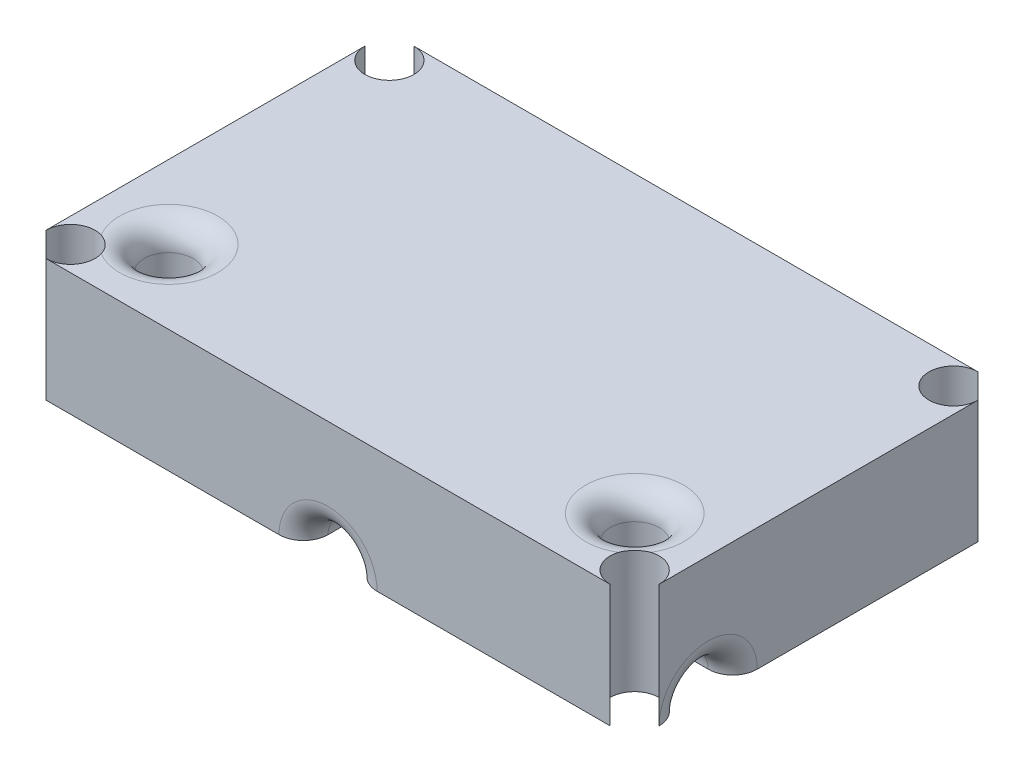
SolidWorks part; units mm, degrees
ref_plane "Front Plane" through (0, 0, 0) normal (0, 0, 1) x (1, 0, 0)
ref_plane "Top Plane" through (0, 0, 0) normal (0, 1, 0) x (1, 0, 0)
ref_plane "Right Plane" through (0, 0, 0) normal (1, 0, 0) x (0, 0, -1)
sketch "Sketch1" plane through (0, 0, 0) normal (0, 1, 0) x (1, 0, 0)
  line L0 (0, 0) -> (0, 1.1972) construction
  line L1 (11.5, -7.5) -> (-11.5, -7.5)
  line L2 (12.5, -6.5) -> (12.5, 6.5)
  line L3 (11.5, 7.5) -> (-11.5, 7.5)
  line L4 (-12.5, -6.5) -> (-12.5, 6.5)
  line L5 (0, 1.1972) -> (0, 0) construction
  line L6 (0, 0) -> (1.088, 0) construction
  arc A0 (-12.5, 6.5) -> (-11.5, 7.5) centre (-11.5, 6.5) ccw
  arc A1 (12.5, 6.5) -> (11.5, 7.5) centre (11.5, 6.5) cw
  arc A2 (12.5, -6.5) -> (11.5, -7.5) centre (11.5, -6.5) ccw
  arc A3 (-12.5, -6.5) -> (-11.5, -7.5) centre (-11.5, -6.5) cw
  point P0 (0, 0)
  point P11 (0, 0)
  point P13 (-6.507, 4.0703)
  dimension "D5" = 2
  dimension "D1" = 25
  dimension "D2" = 15
  dimension "D3" = 1
  dimension "D4" = 1
extrude "Boss-Extrude1" add sketch "Sketch1" along normal blind 5
sketch "Sketch2" plane through (12.5, 0, 0) normal (1, 0, 0) x (0, 0, -1)
  line L0 (-6.5, 0) -> (6.5, 0) construction
  circle A0 centre (-4.5, 0) radius 1
  dimension "D1" = 2
  dimension "D2" = 3
extrude "Cut-Extrude1" cut sketch "Sketch2" against normal through all both and the other way through all
fillet "Fillet1" radius 1 2 edges at (-12.5, 1, 4.5) (12.5, 1, 4.5)
sketch "Sketch3" plane through (0, 5, 0) normal (0, 1, 0) x (1, 0, 0)
  line L0 (-11.5, -3.5) -> (11.5, -3.5) construction
  line L1 (-12.5, 6.5) -> (-12.5, -6.5) construction
  line L2 (0, 0) -> (0, 0.7339) construction
  circle A0 centre (-9.5, -4.4966) radius 1
  circle A1 centre (9.5, -4.4966) radius 1
  dimension "D1" = 2
  dimension "D2" = 0.9966
  dimension "D3" = 3
extrude "Cut-Extrude2" cut sketch "Sketch3" against normal through all both and the other way through all
fillet "Fillet2" radius 1 2 edges at (-9.5, 5, 3.4966) (9.5, 5, 3.4966)
sketch "Sketch6" plane through (0, 0, 0) normal (0, -1, 0) x (1, 0, 0)
  line L0 (-9.5, -7.5) -> (9.5, -7.5)
  line L1 (-9.5, -7.5) -> (-9.5, 3.75)
  line L2 (9.5, -7.5) -> (9.5, 3.75)
  line L3 (-9.5, 3.75) -> (9.5, 3.75)
  line L4 (11.5, 5.5) -> (-11.5, 5.5) construction
  line L5 (-12.5, -6.5) -> (-12.5, 2.5) construction
  dimension "D1" = 1.75
  dimension "D2" = 3
extrude "Cut-Extrude3" cut sketch "Sketch6" against normal blind 3 and the other way through all
fillet "Fillet3" radius 0.3 1 edges at (0, 0.6614, 3.75)
sketch "Sketch8" plane through (0, 0, 7.5) normal (0, 0, 1) x (1, 0, 0)
  circle A0 centre (0, 0) radius 1
extrude "Cut-Extrude4" cut sketch "Sketch8" against normal through all both and the other way through all
fillet "Fillet4" radius 1 1 edges at (0, 1, 7.5)
